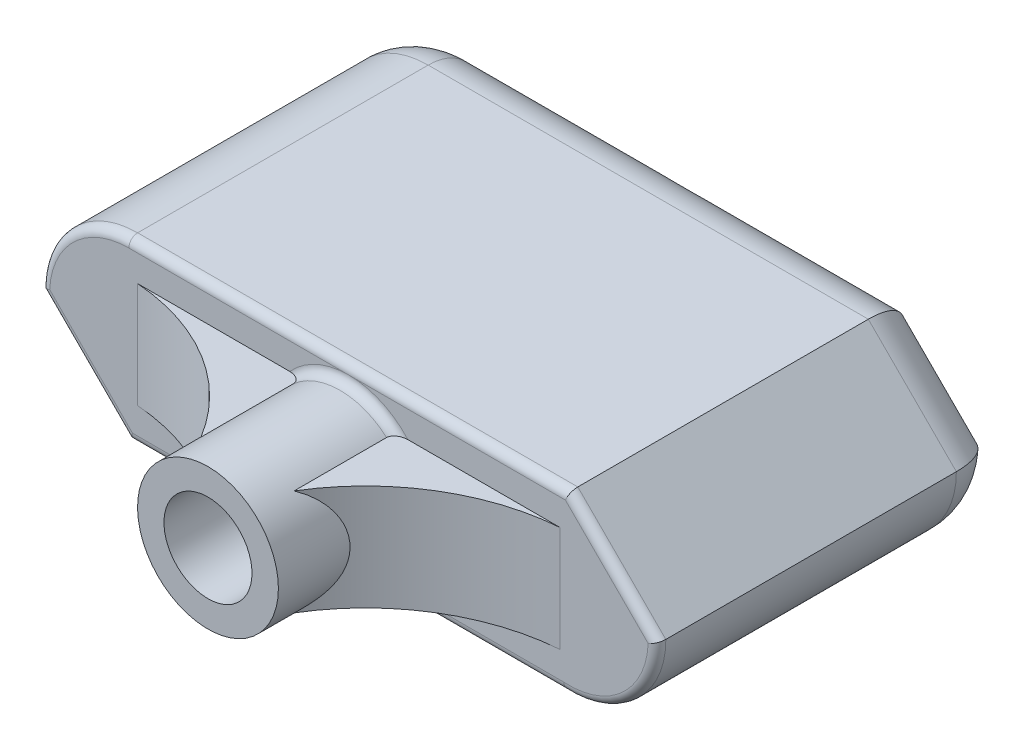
SolidWorks part; units mm, degrees
ref_plane "Plan1" through (0, 0, 0) normal (0, 0, 1) x (1, 0, 0)
ref_plane "Plan2" through (0, 0, 0) normal (0, 1, 0) x (1, 0, 0)
ref_plane "Plan3" through (0, 0, 0) normal (1, 0, 0) x (0, 0, -1)
sketch "Esquisse1" plane through (0, 0, 0) normal (0, 0, 1) x (1, 0, 0)
  circle A0 centre (0, 0) radius 4
  dimension "D1" = 8
extrude "Base-Extrusion" add sketch "Esquisse1" along normal blind 8
sketch "Esquisse2" plane through (0, 0, 0) normal (0, 0, -1) x (-1, 0, 0)
  line L0 (-12.5065, 5) -> (12.4935, 5)
  line L1 (-12.2008, -5) -> (12.4935, -5)
  line L2 (12.4935, -5) -> (17.4935, 0)
  line L3 (-12.5065, 5) -> (-17.5065, 0)
  arc A0 (17.4935, 0) -> (12.4935, 5) centre (12.4935, 0) ccw
  arc A2 (-12.2008, -5) -> (-17.5065, 0) centre (-12.5065, -0.0094) cw
  dimension "D3" = 5
  dimension "D7" = 5
  dimension "D8" = 12.4935
  dimension "D4" = 5
  dimension "D1" = 10
  dimension "D2" = 10
  dimension "D5" = 5
  dimension "D6" = 5
extrude "Boss.-Extru.1" add sketch "Esquisse2" along normal blind 20
sketch "Esquisse3" plane through (0, 0, -20) normal (0, 0, -1) x (-1, 0, 0)
  circle A0 centre (0, 0) radius 3.5
  dimension "D1" = 7
extrude "Enlèv. mat.-Extru.1" cut sketch "Esquisse3" against normal blind 4
fillet "Congé1" radius 3 7 edges at (-3.5, 0, -20) (15.0065, 2.5, -20) (15.9356, -3.6482, -20) (-0.1464, -5, -20) (-14.9935, -2.5, -20) (-16.029, 3.5355, -20) (0.0065, 5, -20)
fillet "Congé5" radius 0.5 7 edges at (15.0065, 2.5, 0) (15.9356, -3.6482, 0) (-0.1464, -5, 0) (-14.9935, -2.5, 0) (-16.029, 3.5355, 0) (0.0065, 5, 0) (4, 0, 0)
sketch "Esquisse4" plane through (0, 0, 8) normal (0, 0, 1) x (1, 0, 0)
  circle A0 centre (0, 0) radius 2.5
  dimension "D1" = 5
extrude "Enlèv. mat.-Extru.2" cut sketch "Esquisse4" against normal through all
sketch "Esquisse5" plane through (0, 0, 0) normal (0, 1, 0) x (1, 0, 0)
  line L2 (2.5, -6) -> (2.5, 0)
  line L3 (12.2994, 0) -> (0, 0) construction
  line L4 (2.5, 0) -> (12, 0)
  line L5 (4, -8) -> (4, -0.5) construction
  line L6 (-2.5, -6) -> (-2.5, 0)
  line L7 (0, 0) -> (-12.4935, 0) construction
  line L8 (-2.5, 0) -> (-12, 0)
  line L9 (-4, -0.5) -> (-4, -8) construction
  arc A0 (12, 0) -> (2.5, -6) centre (12.9123, -11.9653) ccw
  arc A1 (-2.5, -6) -> (-12, 0) centre (-12.9123, -11.9653) ccw
  dimension "D3" = 12
  dimension "D6" = 12
  dimension "D1" = 6
  dimension "D2" = 1.5
  dimension "D4" = 6
  dimension "D5" = 1.5
extrude "Boss.-Extru.2" add sketch "Esquisse5" along normal mid plane 6
